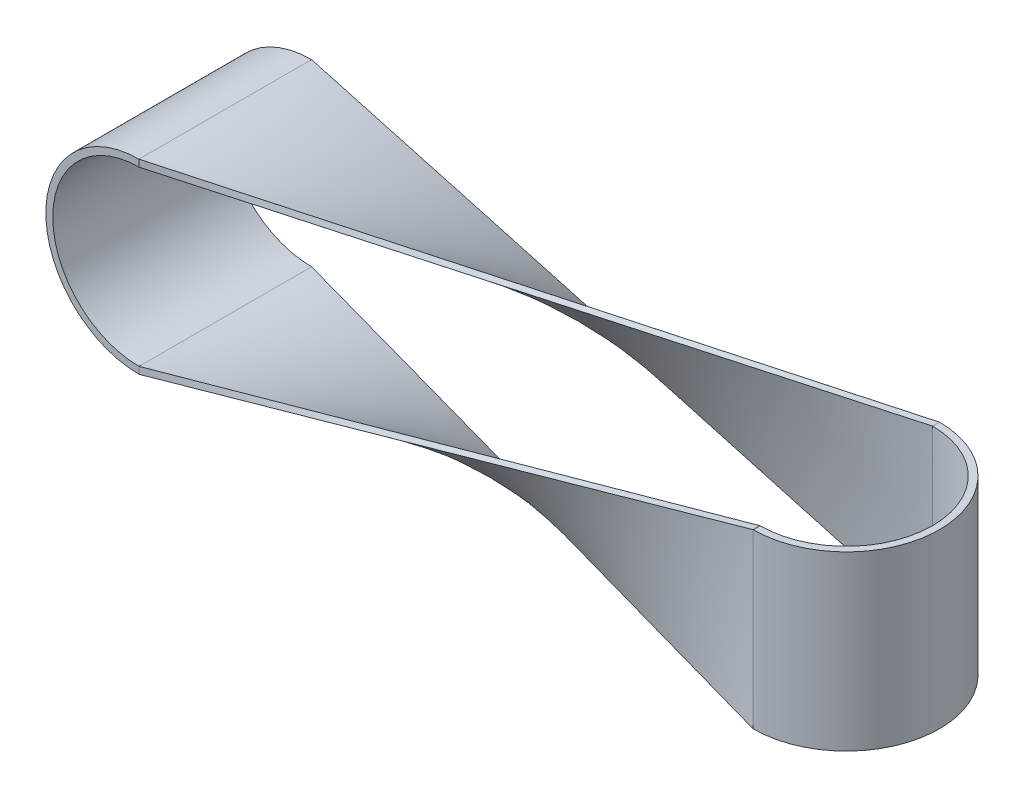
SolidWorks part; units mm, degrees
ref_plane "前视基准面" through (0, 0, 0) normal (0, 0, 1) x (1, 0, 0)
ref_plane "上视基准面" through (0, 0, 0) normal (0, 1, 0) x (1, 0, 0)
ref_plane "右视基准面" through (0, 0, 0) normal (1, 0, 0) x (0, 0, -1)
other "Configuration Table"
sketch "草图1" plane through (0, 0, 0) normal (0, 0, 1) x (1, 0, 0)
  line L0 (0, 0) -> (180, 0) construction
  line L5 (0, -27) -> (0, -25)
  line L6 (0, 25) -> (0, 27)
  line L7 (0, 25) -> (180, 25) construction
  line L8 (0, 27) -> (180, 27) construction
  line L9 (0, -27) -> (180, -27) construction
  line L10 (0, -25) -> (180, -25) construction
  arc A0 (0, 25) -> (0, -25) centre (0, 0) ccw
  arc A3 (0, 27) -> (0, -27) centre (0, 0) ccw
  arc A4 (180, -25) -> (180, 25) centre (180, 0) ccw construction
  arc A5 (180, -27) -> (180, 27) centre (180, 0) ccw construction
  point P3 (90, 0)
  dimension "D2" = 25
  dimension "D3" = 2
extrude "凸台-拉伸1" add sketch "草图1" along normal blind 50
sketch "草图2" plane through (0, 0, 0) normal (0, 1, 0) x (1, 0, 0)
  line L0 (0, -25) -> (241.6425, -25) construction
  line L1 (0, -50) -> (0, 0) construction
  line L2 (180, 17.6947) -> (180, -73.7169) construction
  line L3 (180, 2) -> (180, 0)
  line L4 (180, -50) -> (180, -52)
  arc A0 (180, -50) -> (180, 0) centre (180, -25) ccw
  arc A1 (180, -52) -> (180, 2) centre (180, -25) ccw
  circle A3 centre (180, -25) radius 27 construction
  circle A4 centre (180, -25) radius 25 construction
  point P9 (203.9076, -17.6907)
  point P12 (207, -25)
  dimension "D2" = 50
  dimension "D3" = 2
  dimension "D1" = 180
extrude "凸台-拉伸2" add sketch "草图2" along normal mid plane 50 separate body
other "边界5"
other "边界6"
